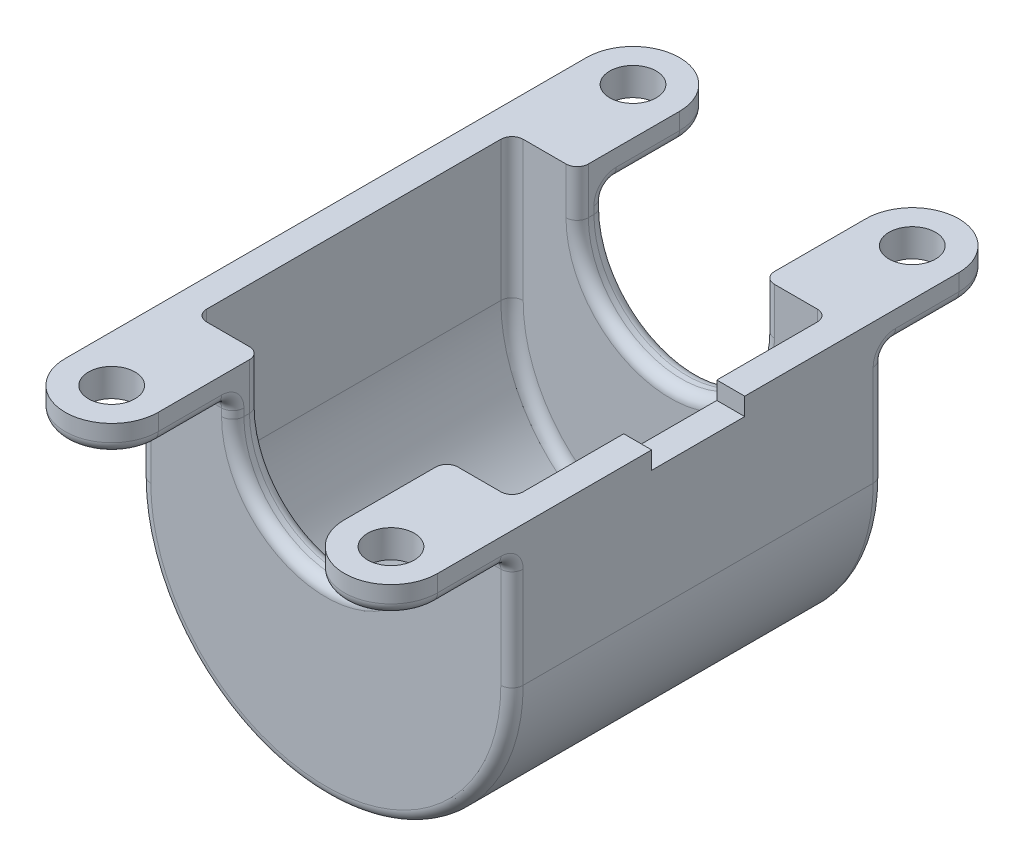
SolidWorks part; units mm, degrees
other "DetailItem1"
ref_plane "Front" through (0, 0, 0) normal (0, 0, 1) x (1, 0, 0)
ref_plane "Top" through (0, 0, 0) normal (0, 1, 0) x (1, 0, 0)
ref_plane "Right" through (0, 0, 0) normal (1, 0, 0) x (0, 0, -1)
sketch "Sketch1" plane through (0, 0, 0) normal (0, 0, 1) x (1, 0, 0)
  line L0 (-50.8, 0) -> (-50.8, 38.1)
  line L1 (-50.8, 38.1) -> (-25.4, 38.1)
  line L2 (-25.4, 38.1) -> (-25.4, 25.4)
  line L3 (50.8, 0) -> (50.8, 38.1)
  line L4 (50.8, 38.1) -> (25.4, 38.1)
  line L5 (25.4, 38.1) -> (25.4, 25.4)
  arc A0 (50.8, 0) -> (-50.8, 0) centre (0, 0) cw
  arc A1 (25.4, 25.4) -> (-25.4, 25.4) centre (0, 25.4) cw
  dimension "D1" = 50.8
  dimension "D2" = 25.4
  dimension "D3" = 38.1
extrude "Base-Extrude" add sketch "Sketch1" along normal mid plane 101.6
shell "Shell1" thickness 7.62
sketch "Sketch2" plane through (0, 38.1, 0) normal (0, 1, 0) x (-1, 0, 0)
  line L0 (50.8, 50.8) -> (50.8, 71.12)
  line L1 (50.8, 50.8) -> (25.4, 50.8)
  line L2 (25.4, 50.8) -> (25.4, 71.12)
  arc A0 (25.4, 71.12) -> (50.8, 71.12) centre (38.1, 71.12) cw
  dimension "D1" = 20.32
extrude "Boss-Extrude1" add sketch "Sketch2" against normal blind 7.62
sketch "Sketch3" plane through (0, 38.1, 0) normal (0, 1, 0) x (-1, 0, 0)
  circle A0 centre (38.1, 71.12) radius 6.35
  dimension "D1" = 12.7
extrude "Cut-Extrude1" cut sketch "Sketch3" against normal through all
mirror "Mirror1" about plane through (0, 0, 0) normal (1, 0, 0) of "Cut-Extrude1", "Boss-Extrude1"
mirror "Mirror2" about plane through (0, 0, 0) normal (0, 0, 1) of "Mirror1", "Boss-Extrude1", "Cut-Extrude1"
sketch "Sketch4" plane through (50.8, 0, 0) normal (1, 0, 0) x (0, 0, -1)
  line L0 (-71.12, 38.1) -> (71.12, 38.1) construction
  line L1 (-12.7, 38.1) -> (12.7, 38.1)
  line L2 (-12.7, 38.1) -> (-12.7, 33.274)
  line L3 (-12.7, 33.274) -> (12.7, 33.274)
  line L4 (12.7, 38.1) -> (12.7, 33.274)
  line L5 (0, 0) -> (0, 38.1) construction
  dimension "D1" = 4.826
  dimension "D2" = 25.4
extrude "Cut-Extrude2" cut sketch "Sketch4" against normal up to next
fillet "Fillet1" radius 3.048 8 edges at (-38.1, 30.48, -50.8) (38.1, 30.48, 50.8)
fillet "Fillet2" radius 3.048 44 edges at (-38.1, 30.48, -83.82) (-25.4, 30.48, -62.484) (-50.8, 30.48, -62.484) (-50.8, 13.716, -50.8) (50.8, 30.48, 62.484) (25.4, 26.416, 50.8) (-50.8, 29.5873, -51.6927) (-25.4, 29.5873, -51.6927) (50.8, 29.5873, -51.6927) (25.4, 29.5873, -51.6927) (50.8, 29.5873, 51.6927) (25.4, 29.5873, 51.6927) (-50.8, 29.5873, 51.6927) (-25.4, 29.5873, 51.6927) (0, 0, 50.8) (0, -43.18, -43.18) (43.18, 19.05, -43.18) (25.4, 31.75, -43.18) (0, 0, -43.18) (-25.4, 31.75, -43.18) (-43.18, 19.05, -43.18) (0, -43.18, 43.18) (43.18, 19.05, 43.18) (25.4, 31.75, 43.18) (0, 0, 43.18) (-25.4, 31.75, 43.18) (-43.18, 19.05, 43.18) (0, -50.8, 50.8) (-38.1, 30.48, 83.82) (38.1, 30.48, 83.82) (25.4, 30.48, 62.484) (50.8, 13.716, 50.8) (-25.4, 26.416, -50.8) (0, 0, -50.8) (38.1, 30.48, -83.82) (0, -50.8, -50.8)
